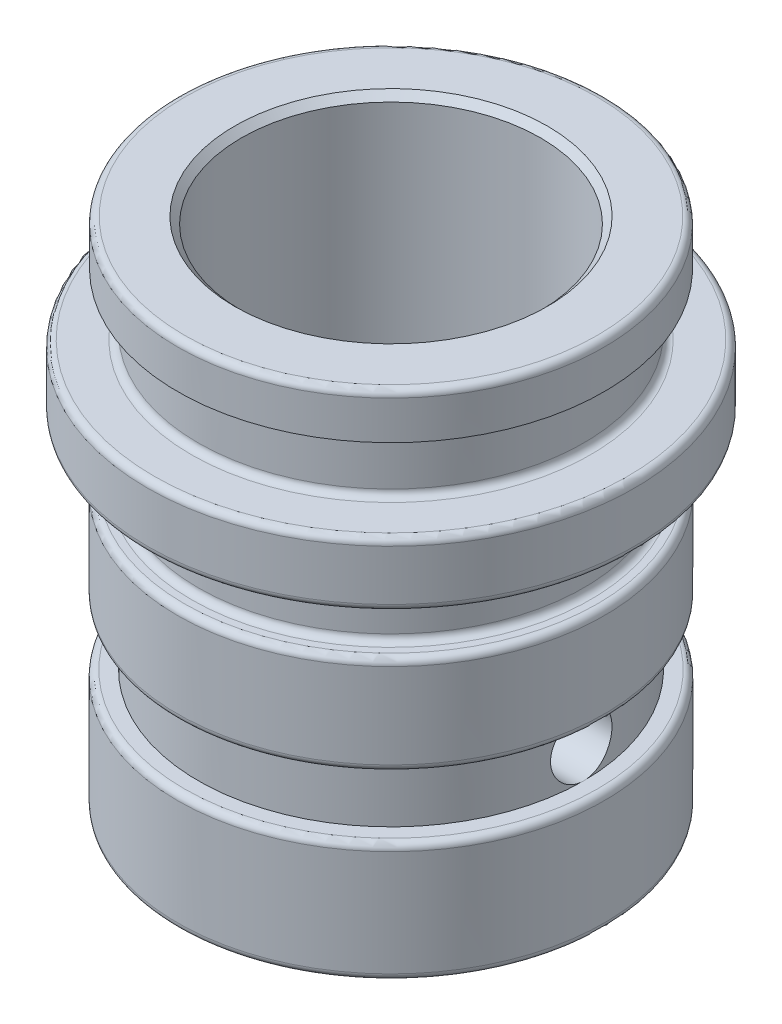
SolidWorks part; units mm, degrees
ref_plane "Front Plane" through (0, 0, 0) normal (0, 0, 1) x (1, 0, 0)
ref_plane "Top Plane" through (0, 0, 0) normal (0, 1, 0) x (1, 0, 0)
ref_plane "Right Plane" through (0, 0, 0) normal (1, 0, 0) x (0, 0, -1)
sketch "Sketch1" plane through (0, 0, 0) normal (0, 0, 1) x (1, 0, 0)
  line L0 (15.8813, 0) -> (15.8813, 8.89)
  line L1 (15.8813, 8.89) -> (14.3383, 8.89)
  line L2 (14.3383, 8.89) -> (14.3383, 13.462)
  line L3 (14.3383, 13.462) -> (15.8813, 13.462)
  line L4 (15.8813, 13.462) -> (15.8813, 20.8153)
  line L5 (15.8813, 20.8153) -> (14.3383, 20.8153)
  line L6 (14.3383, 20.8153) -> (14.3383, 25.3873)
  line L7 (14.3383, 25.3873) -> (18.1229, 25.3873)
  line L8 (18.1229, 25.3873) -> (18.1229, 30.1498)
  line L9 (18.1229, 30.1498) -> (14.3383, 30.1498)
  line L10 (14.3383, 30.1498) -> (14.3383, 34.7218)
  line L11 (14.3383, 34.7218) -> (15.8623, 34.7218)
  line L12 (15.8623, 34.7218) -> (15.8623, 38.1)
  line L13 (15.8623, 38.1) -> (0, 38.1)
  line L14 (0, 0) -> (0, 57.6032) construction
  line L15 (15.8813, 0) -> (0, 0)
  line L16 (0, 38.1) -> (0, 0)
  line L17 (14.3383, 11.176) -> (28.5115, 11.176) construction
  dimension "D1" = 38.1
  dimension "D2" = 4.7625
  dimension "D3" = 15.8623
  dimension "D4" = 18.1229
  dimension "D5" = 15.8813
  dimension "D6" = 30.1498
  dimension "D7" = 4.572
  dimension "D8" = 1.524
  dimension "D9" = 18.9738
revolve "Revolve1" add sketch "Sketch1" angle 360 about L14
sketch "Sketch2" plane through (0, 38.1, 0) normal (0, 1, 0) x (1, 0, 0)
  circle A0 centre (0, 0) radius 11.1252
  dimension "D1" = 22.2504
extrude "Extrude1" cut sketch "Sketch2" against normal through all
chamfer "Chamfer1" distance 0.508 distance2 0.508 1 edges at (0, 38.1, 11.1252)
sketch "Sketch3" plane through (0, 0, 0) normal (1, 0, 0) x (0, 0, -1)
  line L0 (18.1229, 30.1498) -> (-18.1229, 30.1498) construction
  circle A0 centre (0, 11.176) radius 2.286
  dimension "D2" = 4.572
  dimension "D1" = 18.9738
extrude "Extrude2" cut sketch "Sketch3" against normal through all and the other way through all
fillet "Fillet1" radius 0.508 14 edges at (0, 38.1, -15.8623) (0, 34.7218, -14.3383) (0, 30.1498, -14.3383) (0, 30.1498, -18.1229) (0, 25.3873, -18.1229) (0, 25.3873, -14.3383) (0, 20.8153, -14.3383) (0, 20.8153, -15.8813) (0, 13.462, -15.8813) (0, 13.462, 14.3383) (0, 8.89, -15.8813) (0, 0, -15.8813) (0, 0, 11.1252) (0, 13.462, -14.3383)
